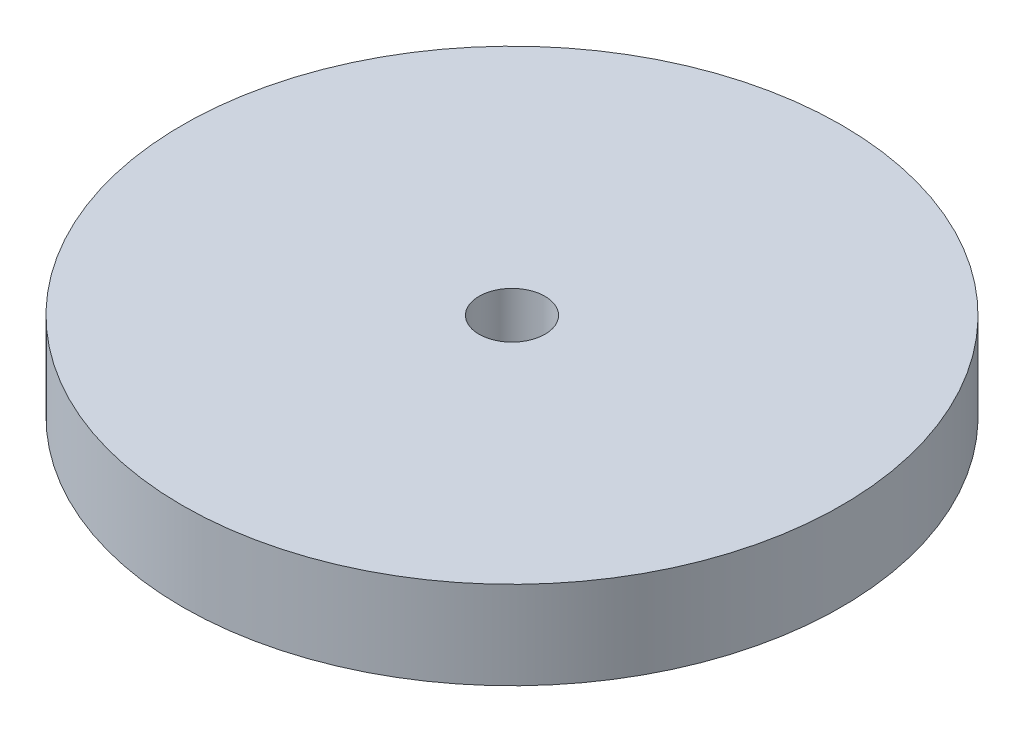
SolidWorks part; units mm, degrees
ref_plane "Front" through (0, 0, 0) normal (0, 0, 1) x (1, 0, 0)
ref_plane "Top" through (0, 0, 0) normal (0, 1, 0) x (1, 0, 0)
ref_plane "Right" through (0, 0, 0) normal (1, 0, 0) x (0, 0, -1)
sketch "Sketch1" plane through (0, 0, 0) normal (0, 1, 0) x (1, 0, 0)
  circle A0 centre (0, 0) radius 75
  dimension "D1" = 150
extrude "Extrude1" add sketch "Sketch1" along normal blind 20
sketch "Sketch3" plane through (0, 20, 0) normal (0, 1, 0) x (-1, 0, 0)
  circle A0 centre (0, 0) radius 7.5
  dimension "D1" = 15
extrude "Cut-Extrude1" cut sketch "Sketch3" against normal through all
sketch "Sketch2" plane through (0, 20, 0) normal (0, 1, 0) x (-1, 0, 0)
  point P0 (20, -55)
  point P1 (40, 0)
  point P2 (20, 55)
  point P3 (-40, 0)
  point P4 (-20, -55)
  point P6 (-20, 55)
  dimension "D1" = 40
  dimension "D2" = 20
  dimension "D3" = 60
  dimension "D4" = 80
  dimension "D5" = 55
  dimension "D6" = 55
